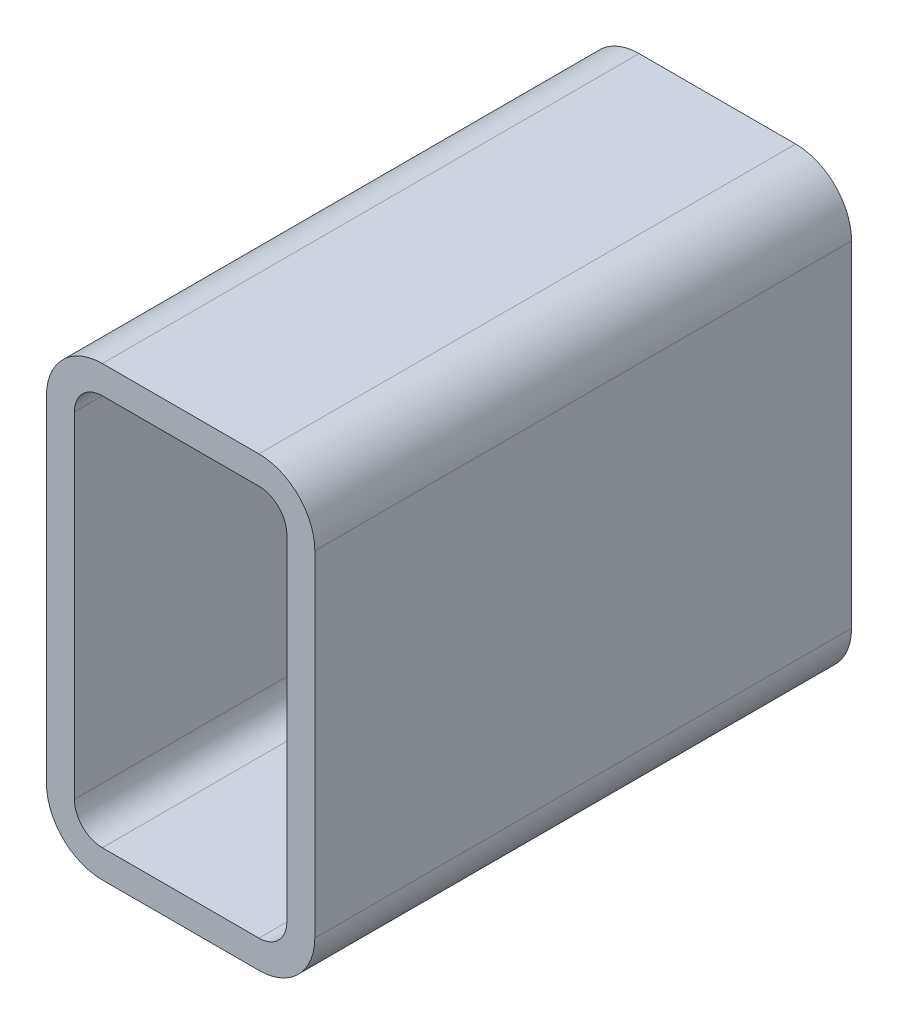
SolidWorks part; units mm, degrees
ref_plane "Front Plane" through (0, 0, 0) normal (0, 0, 1) x (1, 0, 0)
ref_plane "Top Plane" through (0, 0, 0) normal (0, 1, 0) x (1, 0, 0)
ref_plane "Right Plane" through (0, 0, 0) normal (1, 0, 0) x (0, 0, -1)
sketch "Sketch1" plane through (0, 0, 0) normal (0, 0, 1) x (1, 0, 0)
sketch_block_instance "HSS10x6x0.625-1"
sketch_block "HSS10x6x0.625"
extrude "Boss-Extrude1" add sketch "Sketch1" along normal blind 304.8
